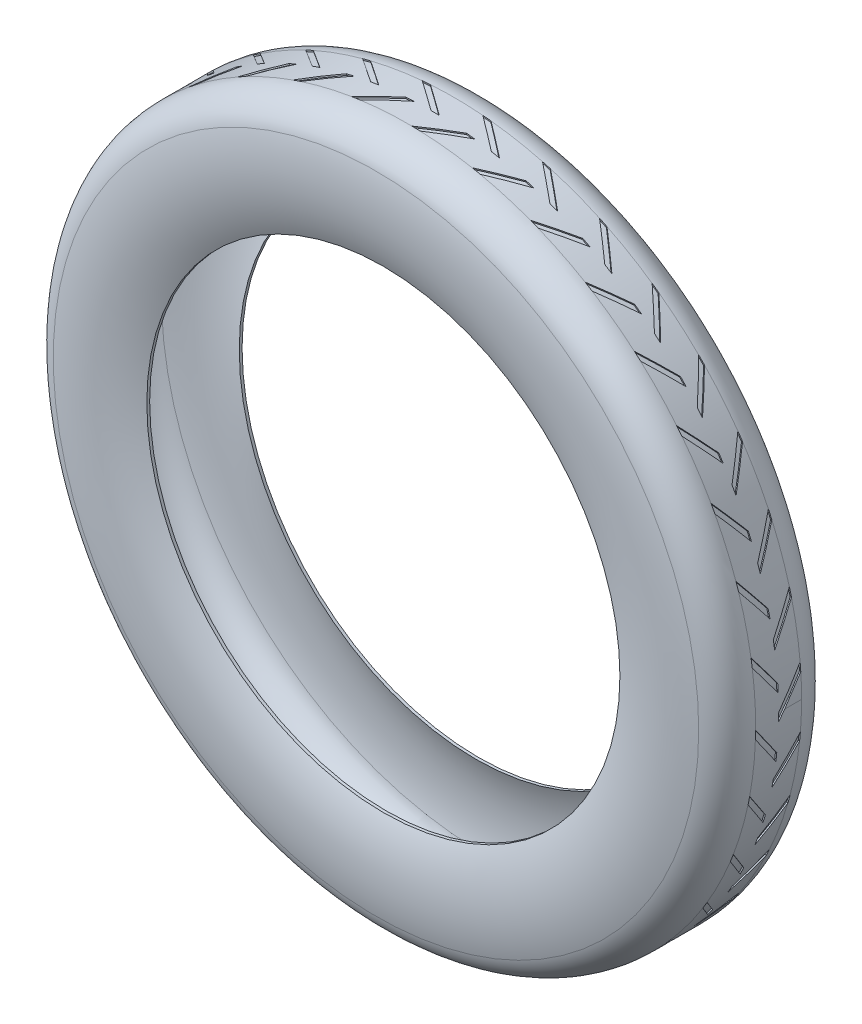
SolidWorks part; units mm, degrees
ref_plane "Front Plane" through (0, 0, 0) normal (0, 0, 1) x (1, 0, 0)
ref_plane "Top Plane" through (0, 0, 0) normal (0, 1, 0) x (1, 0, 0)
ref_plane "Right Plane" through (0, 0, 0) normal (1, 0, 0) x (0, 0, -1)
sketch "Sketch1" plane through (0, 0, 0) normal (1, 0, 0) x (0, 0, -1)
  line L0 (-58.8234, 0) -> (66.8614, 0) construction
  line L1 (0, -58.0013) -> (0, 67.5007) construction
  line L2 (-22.25, 336.5) -> (22.25, 336.5)
  line L3 (-69.7817, 280.938) -> (53.2501, 312.4367) construction
  line L4 (-69.7817, 280.938) -> (46.1124, 229) construction
  line L5 (-46.1124, 229) -> (46.1124, 229)
  arc A0 (22.25, 336.5) -> (53.2501, 312.4367) centre (22.25, 304.5) cw
  arc A1 (-22.25, 336.5) -> (-53.2501, 312.4367) centre (-22.25, 304.5) ccw
  arc A2 (46.1124, 229) -> (53.2501, 312.4367) centre (-69.7817, 280.938) ccw
  arc A3 (-46.1124, 229) -> (-53.2501, 312.4367) centre (69.7817, 280.938) cw
  point P8 (0, 336.5)
  dimension "D3" = 32
  dimension "D4" = 458
  dimension "D5" = 127
  dimension "D1" = 44.5
  dimension "D2" = 673
  dimension "D6" = 38.5
revolve "Revolve1" add sketch "Sketch1" angle 360 about L0
shell "Shell1" thickness 2.5
ref_plane "Plane1" through (0, 390, 0) normal (0, 1, 0) x (1, 0, 0)
sketch "Sketch2" plane through (0, 390, 0) normal (0, 1, 0) x (1, 0, 0)
  line L0 (-168.6107, 0) -> (172.9815, 0) construction
  line L1 (-30.8048, 22.25) -> (-22.8048, 22.25)
  line L2 (-30.8048, 22.25) -> (0, 0)
  line L3 (-22.8048, 22.25) -> (8, 0)
  line L4 (0, 0) -> (8, 0)
  line L5 (336.5, 22.25) -> (-336.5, 22.25) construction
  line L6 (34.5, 0) -> (42.5, 0)
  line L7 (34.5, 0) -> (3.6952, -22.25)
  line L8 (42.5, 0) -> (11.6952, -22.25)
  line L9 (3.6952, -22.25) -> (11.6952, -22.25)
  line L10 (336.5, -22.25) -> (-336.5, -22.25) construction
  dimension "D1" = 8
  dimension "D2" = 38
  dimension "D3" = 0
  dimension "D4" = 8
  dimension "D5" = 38
  dimension "D6" = 34.5
wrap "Wrap1" sketch "Sketch2" wrap type deboss source sketch "Sketch2" thickness 1.25 parameters "D1"=1.25
pattern_circular "CirPattern1" count 36 over 360 about axis through (0, 0, -46.1124) along (0, 0, 1) of "Wrap1"
